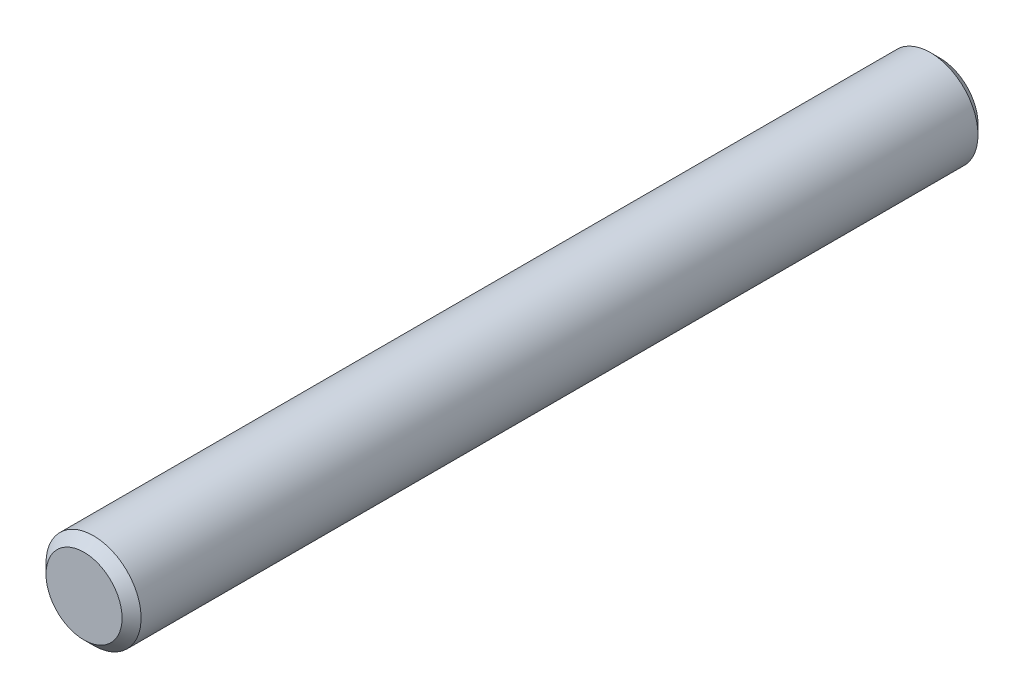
SolidWorks part; units mm, degrees
ref_plane "Plan de face" through (0, 0, 0) normal (0, 0, 1) x (1, 0, 0)
ref_plane "Plan de dessus" through (0, 0, 0) normal (0, 1, 0) x (1, 0, 0)
ref_plane "Plan de droite" through (0, 0, 0) normal (1, 0, 0) x (0, 0, -1)
sketch "Esquisse1" plane through (0, 0, 0) normal (0, 0, 1) x (1, 0, 0)
  circle A0 centre (0, 0) radius 2.5
  dimension "D1" = 5
extrude "Extrusion1" add sketch "Esquisse1" along normal mid plane 45
chamfer "Chanfrein1" distance 0.5 angle 45 2 edges at (2.5, 0, -22.5) (2.5, 0, 22.5)
